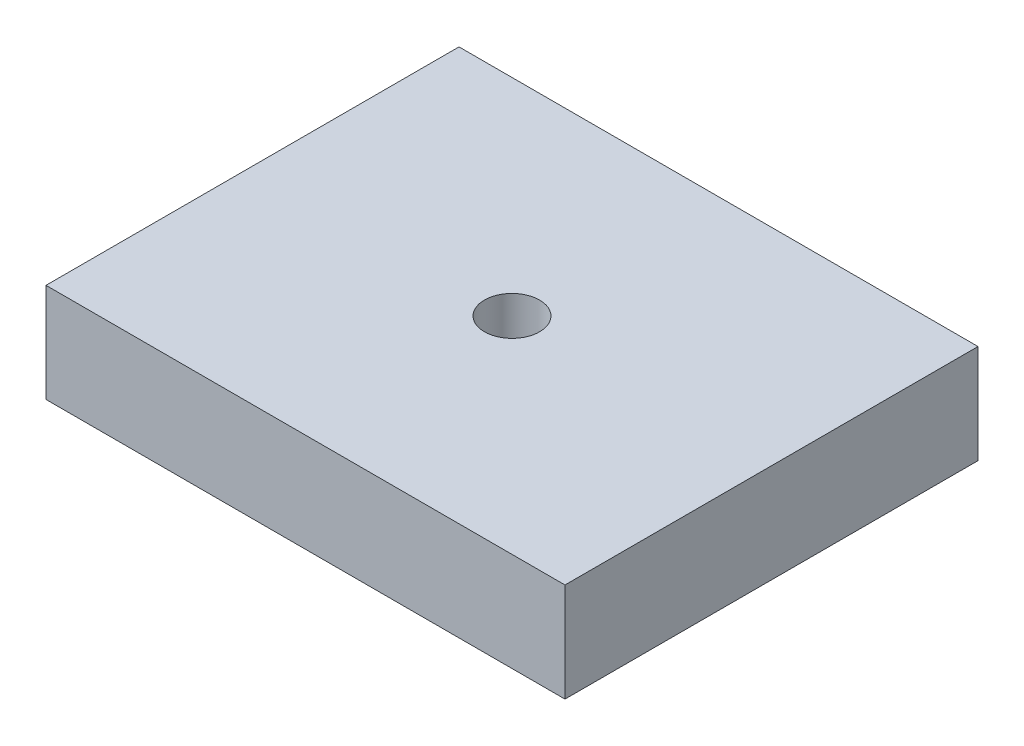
SolidWorks part; units mm, degrees
ref_plane "Front Plane" through (0, 0, 0) normal (0, 0, 1) x (1, 0, 0)
ref_plane "Top Plane" through (0, 0, 0) normal (0, 1, 0) x (1, 0, 0)
ref_plane "Right Plane" through (0, 0, 0) normal (1, 0, 0) x (0, 0, -1)
sketch "Sketch1"
extrude "Extrude1" add sketch "Sketch1" along normal blind 11.8471
sketch "Sketch2"
  dimension "D1" = 6.604
extrude "Extrude2" cut sketch "Sketch2" against normal blind 73.152
